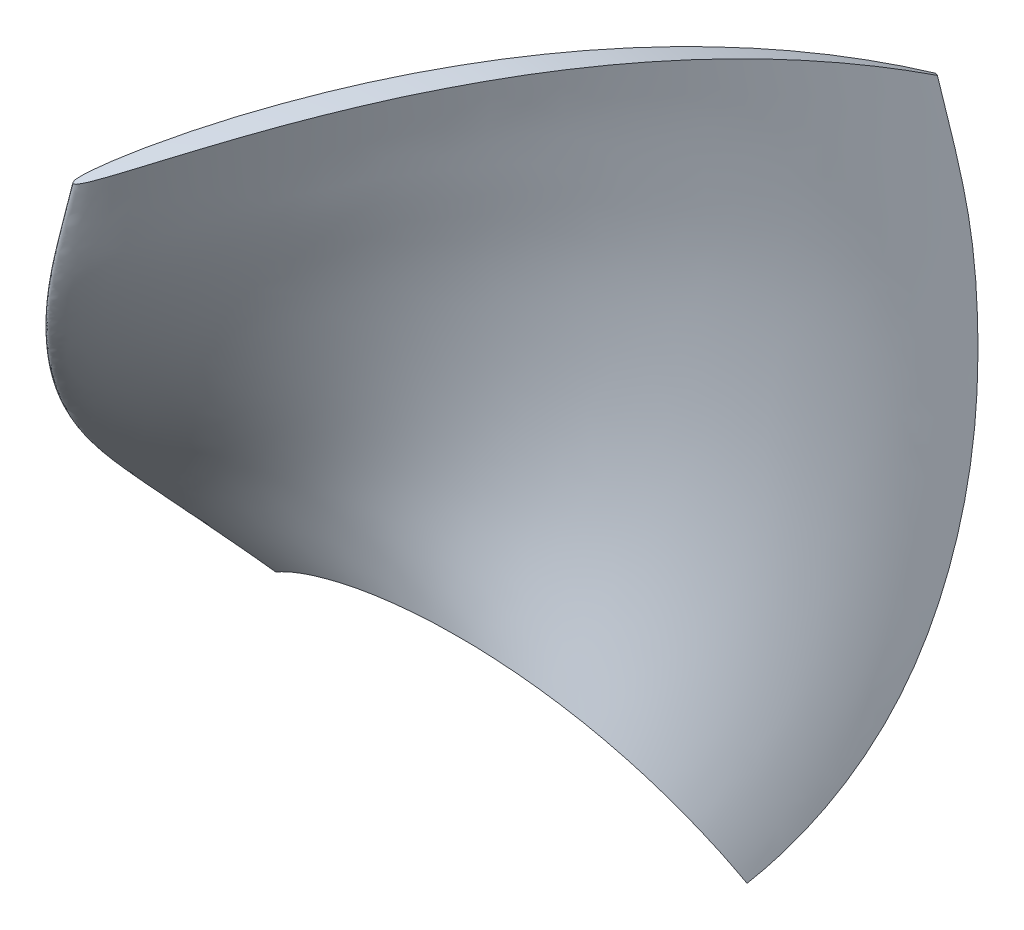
SolidWorks part; units mm, degrees
other "<SpiegelnKaplanfluegel>-<<Kaplanfluegel>-<Oberflächenausfüllung5>>"
ref_plane "Ebene vorne" through (0, 0, 0) normal (0, 0, 1) x (1, 0, 0)
ref_plane "Ebene oben" through (0, 0, 0) normal (0, 1, 0) x (1, 0, 0)
ref_plane "Ebene rechts" through (0, 0, 0) normal (1, 0, 0) x (0, 0, -1)
ref_plane "Ebene vorne-SpiegelnKaplanfluegel" through (0, 0, 0) normal (0, 0, 1) x (1, 0, 0)
ref_plane "Ebene oben-SpiegelnKaplanfluegel" through (0, 0, 0) normal (0, 1, 0) x (1, 0, 0)
ref_plane "Ebene rechts-SpiegelnKaplanfluegel" through (0, 0, 0) normal (1, 0, 0) x (0, 0, -1)
inserted part "SpiegelnKaplanfluegel"
move or copy body "Körper-Verschieben/Kopieren2"
scale "Skalieren1" scale about origin uniform scaling yes scale factor 1.5
sketch "Skizze1" plane through (0, 0, 0) normal (1, 0, 0) x (0, 0, -1)
  line L0 (295.804, 50) -> (-295.804, 50)
  line L1 (-427.3257, 0) -> (432.5058, 0) construction
  arc A0 (295.804, 50) -> (-295.804, 50) centre (0, 0) ccw
  dimension "D1" = 600
  dimension "D2" = 50
revolve "Schnitt-Rotation2" cut sketch "Skizze1" angle 360 about L1
equation "\"Gesamtgewicht\"=\"SW-Masse\"/1000"
